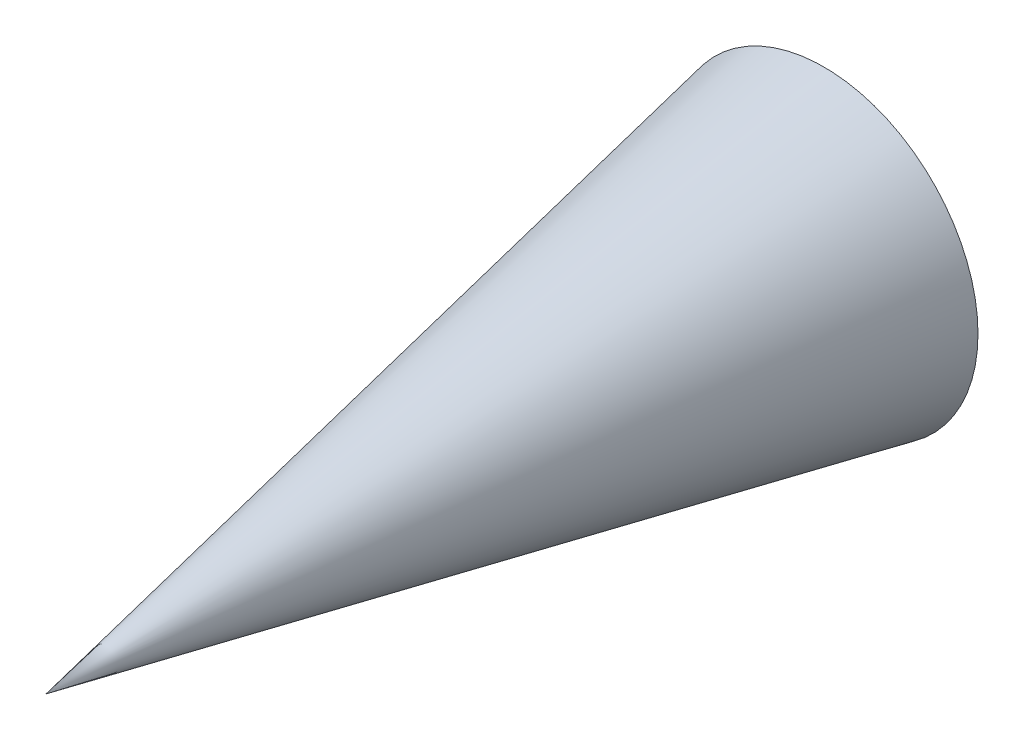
SolidWorks part; units mm, degrees
ref_plane "Front Plane" through (0, 0, 0) normal (0, 0, 1) x (1, 0, 0)
ref_plane "Top Plane" through (0, 0, 0) normal (0, 1, 0) x (1, 0, 0)
ref_plane "Right Plane" through (0, 0, 0) normal (1, 0, 0) x (0, 0, -1)
sketch "Sketch1" plane through (0, 0, 0) normal (1, 0, 0) x (0, 0, -1)
  line L0 (0, 0) -> (125, 0) construction
  line L1 (125, 0) -> (125, 24.76)
  line L2 (125, 24.76) -> (0, 0)
  line L3 (0, 0) -> (125, 0)
  point P4 (50.7, 0)
  dimension "D1" = 125
  dimension "D2" = 24.76
  dimension "D3" = 74.3
revolve "light_cone" add sketch "Sketch1" angle 360 about L0
ref_plane "Plane1" through (0, 0, -50.7) normal (0, 0, -1) x (-1, 0, 0)
sketch "Sketch2" plane through (0, 0, -50.7) normal (0, 0, -1) x (-1, 0, 0)
  circle A0 centre (0, 0) radius 5.25
  dimension "D1" = 10.5
